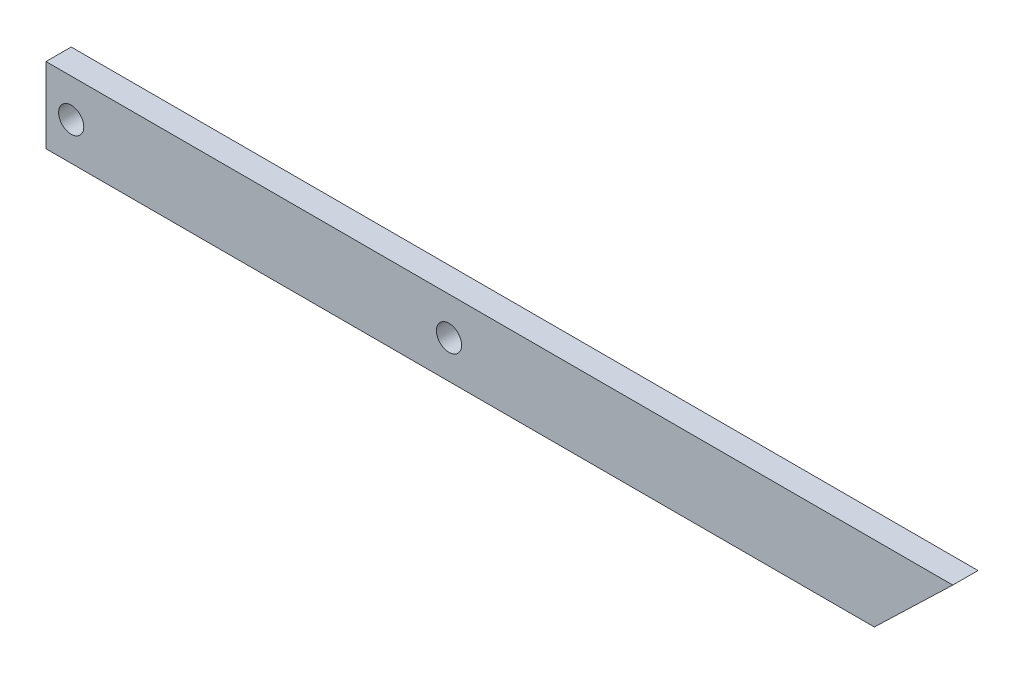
SolidWorks part; units mm, degrees
ref_plane "Ebene vorne" through (0, 0, 0) normal (0, 0, 1) x (1, 0, 0)
ref_plane "Ebene oben" through (0, 0, 0) normal (0, 1, 0) x (1, 0, 0)
ref_plane "Ebene rechts" through (0, 0, 0) normal (1, 0, 0) x (0, 0, -1)
sketch "Skizze1" plane through (0, 0, 0) normal (0, 0, 1) x (1, 0, 0)
  line L0 (260, 30) -> (228.842, 0)
  line L1 (-100, 30) -> (260, 30)
  line L2 (-100, 30) -> (-100, 0)
  line L3 (-100, 0) -> (228.842, 0)
  circle A0 centre (-90, 15) radius 5
  circle A1 centre (60, 15) radius 5
  dimension "D3" = 10
  dimension "D4" = 10
  dimension "D1" = 30
  dimension "D2" = 15
  dimension "D5" = 10
  dimension "D6" = 150
  dimension "D7" = 15
extrude "Linear austragen1" add sketch "Skizze1" along normal blind 10
